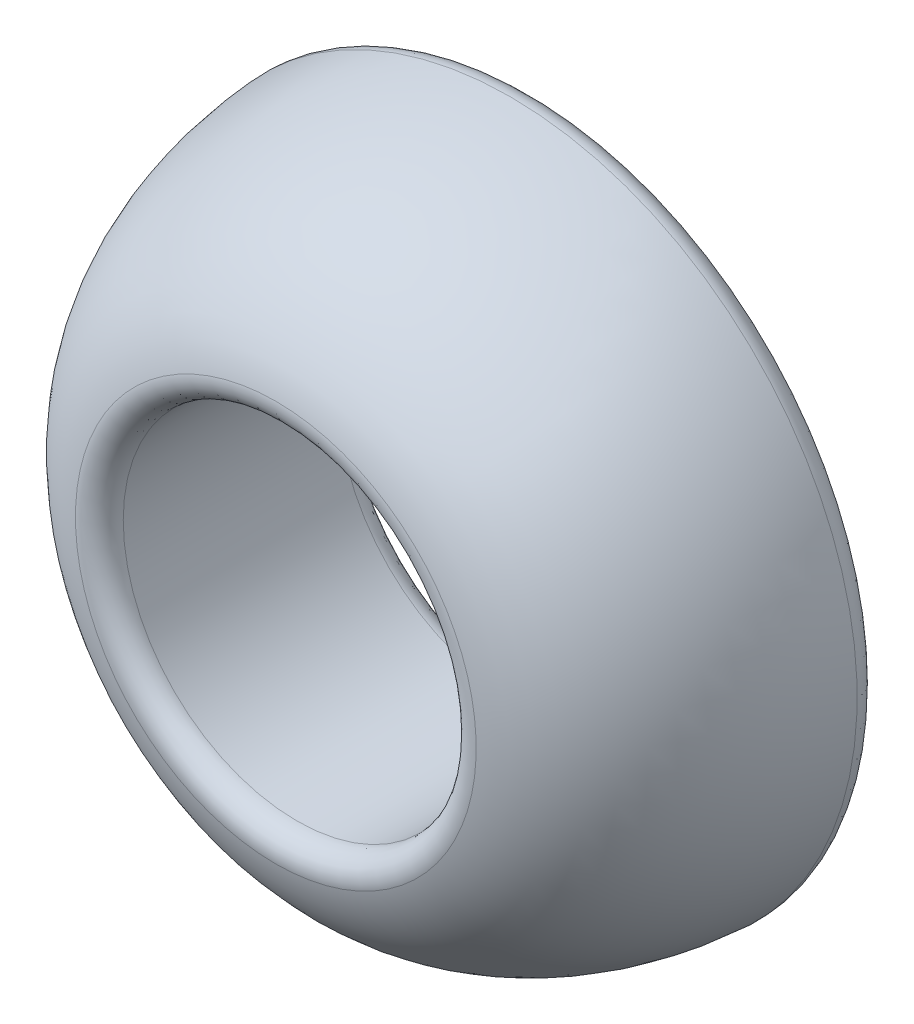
SolidWorks part; units mm, degrees
ref_plane "Спереди" through (0, 0, 0) normal (0, 0, 1) x (1, 0, 0)
ref_plane "Сверху" through (0, 0, 0) normal (0, 1, 0) x (1, 0, 0)
ref_plane "Справа" through (0, 0, 0) normal (1, 0, 0) x (0, 0, -1)
sketch "Эскиз1" plane through (0, 0, 0) normal (1, 0, 0) x (0, 0, -1)
  line L0 (-3, 0) -> (3, 0) construction
  line L2 (-3, 4) -> (3, 4)
  line L3 (3, 4) -> (3, 8)
  ellipse E0 centre (3, 4) end of major axis (9, 4) minor radius 4 (3, 8) -> (-3, 4) ccw
  dimension "D1" = 8
  dimension "D2" = 16
  dimension "D3" = 6
revolve "Повернуть1" add sketch "Эскиз1" angle 360 about L0
fillet "Скругление1" radius 0.5 3 edges at (4, 0, 3) (4, 0, -3) (8, 0, -3)
